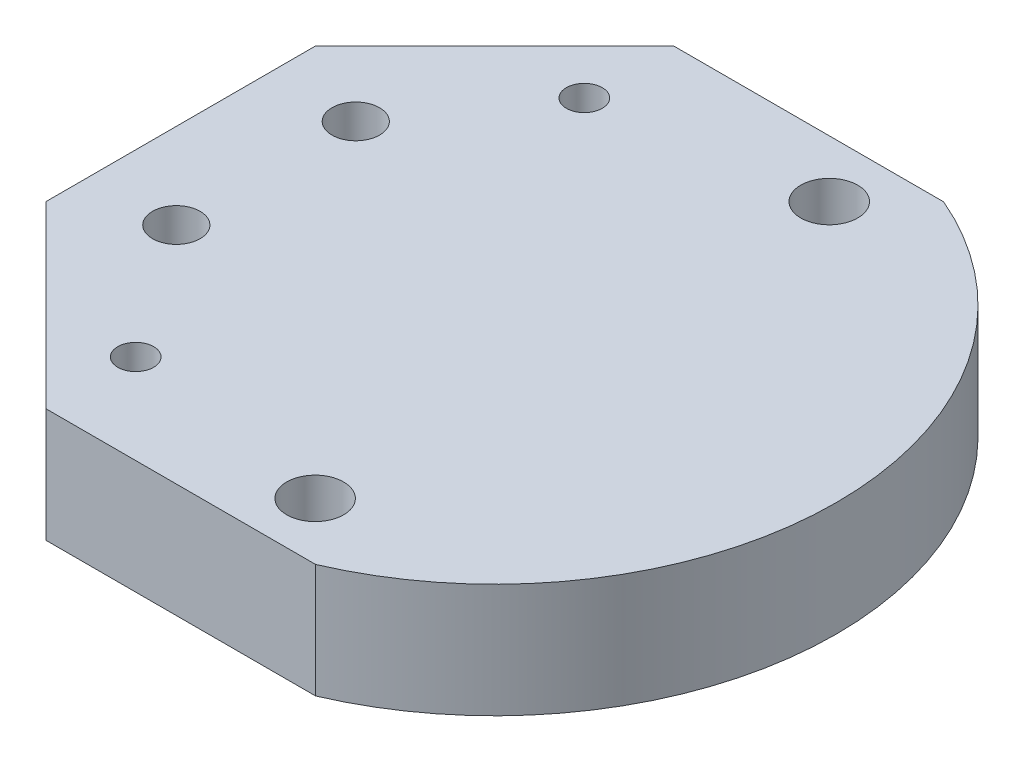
SolidWorks part; units mm, degrees
ref_plane "Front Plane" through (0, 0, 0) normal (0, 0, 1) x (1, 0, 0)
ref_plane "Top Plane" through (0, 0, 0) normal (0, 1, 0) x (1, 0, 0)
ref_plane "Right Plane" through (0, 0, 0) normal (1, 0, 0) x (0, 0, -1)
sketch "Sketch1" plane through (0, 0, 0) normal (0, 1, 0) x (1, 0, 0)
  circle A0 centre (0, 0) radius 38.1
  dimension "D1" = 76.2
extrude "Boss-Extrude2" add sketch "Sketch1" along normal blind 12.7
sketch "Sketch4" plane through (0, 12.7, 0) normal (0, 1, 0) x (1, 0, 0)
  line L0 (-15, 35) -> (-35, 15)
  line L1 (40, 35) -> (-15, 35)
  line L2 (40, 35) -> (40, -35)
  line L3 (40, -35) -> (-15, -35)
  line L4 (-35, 15) -> (-35, -15)
  line L5 (-35, -15) -> (-15, -35)
  point P1 (-35, -35)
  point P3 (-35, 35)
  dimension "D1" = 70
  dimension "D2" = 75
  dimension "D3" = 35
  dimension "D4" = 35
extrude "Cut-Extrude1" cut sketch "Sketch4" against normal blind 12.7 flip side to cut
hole_wizard "1/4 (0.25) Diameter Hole1" positions "Sketch6" profile "Sketch5" hole size "1/4" standard "Ansi Inch"
sketch "Sketch6" plane through (0, 12.7, 0) normal (0, 1, 0) x (-1, 0, 0)
  line L1 (-15.0536, -35) -> (15, -35) construction
  line L2 (15, 35) -> (-15.0536, 35) construction
  point P0 (-8.65, -28.65)
  point P1 (-8.65, 28.65)
  dimension "D1" = 8.65
  dimension "D2" = 6.35
  dimension "D3" = 6.35
  dimension "D4" = 8.65
sketch "Sketch5" plane through (8.65, 12.7, -28.65) normal (1, 0, 0) x (0, 0, 1)
  line L0 (0, 0) -> (0, 12.7)
  line L1 (0, 12.7) -> (3.175, 12.7)
  line L2 (3.175, 12.7) -> (3.175, 0)
  line L5 (3.175, 0) -> (0, 0)
  line L11 (0, -6.35) -> (0, 107.95) construction
  dimension "Thru Hole Dia." = 6.35
  dimension "Thru Hole Depth" = 12.7
hole_wizard "CBORE for M5 SHCS1" positions "Sketch8" profile "Sketch7" counterbore size "M5" standard "Ansi Metric"
sketch "Sketch8" plane through (0, 0, 0) normal (0, -1, 0) x (1, 0, 0)
  line L0 (-35, -15) -> (-35, 15) construction
  point P2 (-25.475, 10)
  point P4 (-25.475, -10)
  dimension "D1" = 10
  dimension "D2" = 10
  dimension "D3" = 9.525
  dimension "D4" = 9.525
sketch "Sketch7" plane through (-25.475, 0, 10) normal (1, 0, 0) x (0, 0, -1)
  line L0 (0, 0) -> (0, 12.7)
  line L1 (0, 12.7) -> (2.65, 12.7)
  line L3 (2.65, 12.7) -> (2.65, 6)
  line L4 (2.65, 6) -> (5, 6)
  line L5 (5, 6) -> (5, 0)
  line L7 (5, 0) -> (0, 0)
  line L11 (0, -6.35) -> (0, 107.95) construction
  dimension "Thru Hole Dia." = 5.3
  dimension "Thru Hole Depth" = 12.7
  dimension "C'Bore Dia." = 10
  dimension "C'Bore Depth" = 6
sketch "Sketch9" plane through (0, 0, 0) normal (0, -1, 0) x (1, 0, 0)
  circle A0 centre (-15, 25) radius 2
  circle A1 centre (-15, -25) radius 2
  dimension "D1" = 25
  dimension "D2" = 25
extrude "Cut-Extrude2" cut sketch "Sketch9" against normal through all
